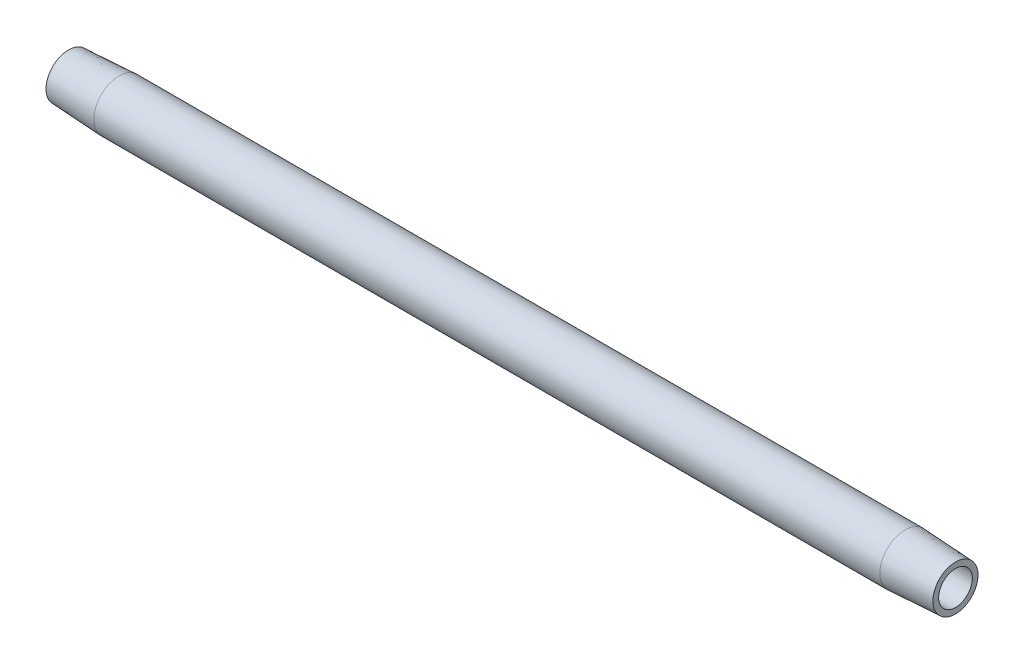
SolidWorks part; units mm, degrees
ref_plane "Front Plane" through (0, 0, 0) normal (0, 0, 1) x (1, 0, 0)
ref_plane "Top Plane" through (0, 0, 0) normal (0, 1, 0) x (1, 0, 0)
ref_plane "Right Plane" through (0, 0, 0) normal (1, 0, 0) x (0, 0, -1)
sketch "Sketch2" plane through (0, 0, 0) normal (0, 0, 1) x (1, 0, 0)
  line L0 (0.4761, 0) -> (50000.4761, 0) construction
  line L1 (0, -11.3625) -> (0, 49988.6375) construction
  line L7 (7.9375, 3.9687) -> (0, 3.5528)
  line L8 (131.7625, 3.9688) -> (7.9375, 3.9687)
  line L9 (139.7, 3.5528) -> (131.7625, 3.9688)
  line L10 (139.7, 2.6543) -> (139.7, 3.5528)
  line L11 (139.7, 2.6543) -> (0, 2.6543)
  line L12 (0, 3.5528) -> (0, 2.6543)
  dimension "D1" = 5.3086
  dimension "D2" = 7.9375
  dimension "D3" = 3
  dimension "D4" = 3
  dimension "D5" = 7.9375
  dimension "D6" = 7.9375
  dimension "D7" = 139.7
revolve "Revolve1" add sketch "Sketch2" angle 360 about L0
